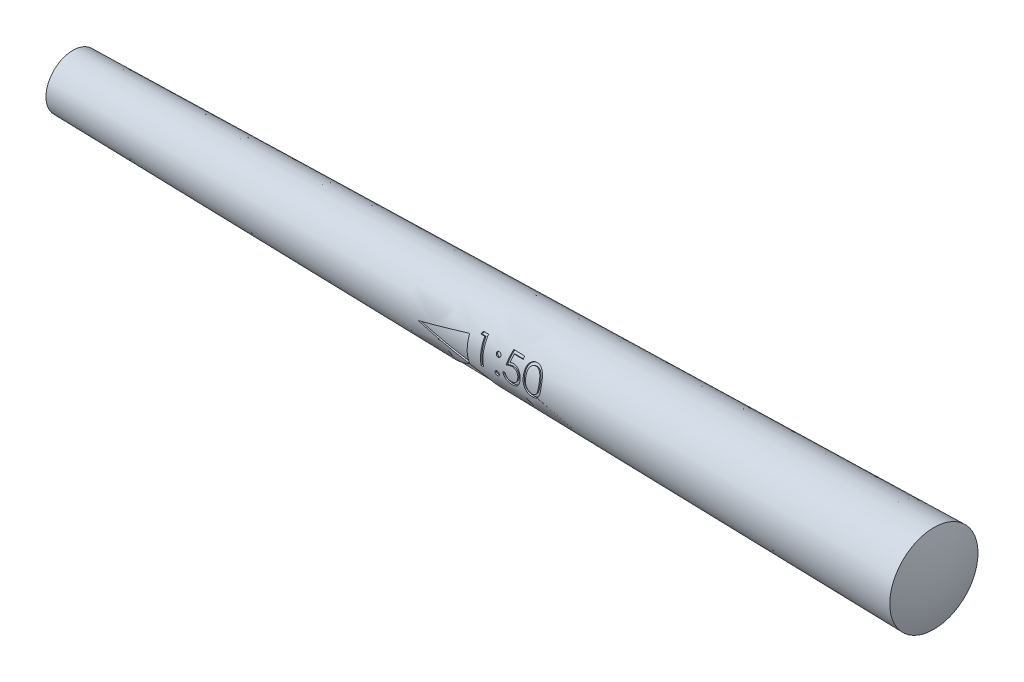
SolidWorks part; units mm, degrees
ref_plane "Front Plane" through (0, 0, 0) normal (0, 0, 1) x (1, 0, 0)
ref_plane "Top Plane" through (0, 0, 0) normal (0, 1, 0) x (1, 0, 0)
ref_plane "Right Plane" through (0, 0, 0) normal (1, 0, 0) x (0, 0, -1)
sketch "Sketch1" plane through (0, 0, 0) normal (1, 0, 0) x (0, 0, -1)
  circle A0 centre (0, 0) radius 1
  dimension "D1" = 2
extrude "Extrude1" add sketch "Sketch1" along normal mid plane 32
draft "Draft1" type of draft neutral plane draft angle 1.146 faces to draft 1 parameters "D1"=1.146
sketch "Sketch2" plane through (0, 0, 0) normal (0, 0, 1) x (1, 0, 0)
  line L0 (-16, 0) -> (-16, 1)
  line L1 (-16, 1) -> (-16, -1) construction
  line L2 (-16, 0) -> (-16.3, 0)
  line L3 (-16.3, 0) -> (-16.3, -1.32) construction
  line L4 (16, 0) -> (16, 1.64)
  line L5 (16, -1.64) -> (16, 1.64) construction
  line L6 (16, 0) -> (16.3, 0)
  line L7 (16.3, 0) -> (16.3, -1.32) construction
  line L8 (-16, -1) -> (16, -1.64) construction
  arc A0 (-16.3, 0) -> (-16, 1) centre (-14.4833, 0) cw
  arc A1 (16.3, 0) -> (16, 1.64) centre (11.6672, 0) ccw
  point P14 (0, -1.32)
revolve "Revolve1" add sketch "Sketch2" angle 360 about L2
sketch "Sketch5" plane through (0, 0, 0) normal (0, 0, 1) x (1, 0, 0)
  line L0 (0, 1.32) -> (0, -1.32) construction
  line L1 (16, 1.64) -> (-16, 1) construction
  line L2 (-16, -1) -> (16, -1.64) construction
ref_plane "Plane2" through (0, 0, 0) normal (-0.02, 0, 0.9998) x (0.9998, 0, 0.02)
sketch "Sketch6" plane through (0, 0, 0) normal (-0.02, 0, 0.9998) x (0.9998, 0, 0.02)
  line L0 (0, 0) -> (0, 0.5)
  line L1 (0, 1.32) -> (0, -1.32) construction
  line L2 (0, 0.5) -> (-1.866, 0)
  line L3 (-1.866, 0) -> (0, -0.5)
  line L4 (0, -0.5) -> (0, 0)
  line L5 (0, -0.25) -> (3, -0.25) construction
  text T0 "1:50" font "Century Gothic" height 1
  dimension "D1" = 1
  dimension "D2" = 30
  dimension "D3" = 3
wrap "Wrap2" sketch "Sketch6" wrap type deboss source sketch "Sketch6" thickness 0.05 parameters "D1"=0.05
equation "\"D2@Sketch2\" = \"D1@Sketch2\""
